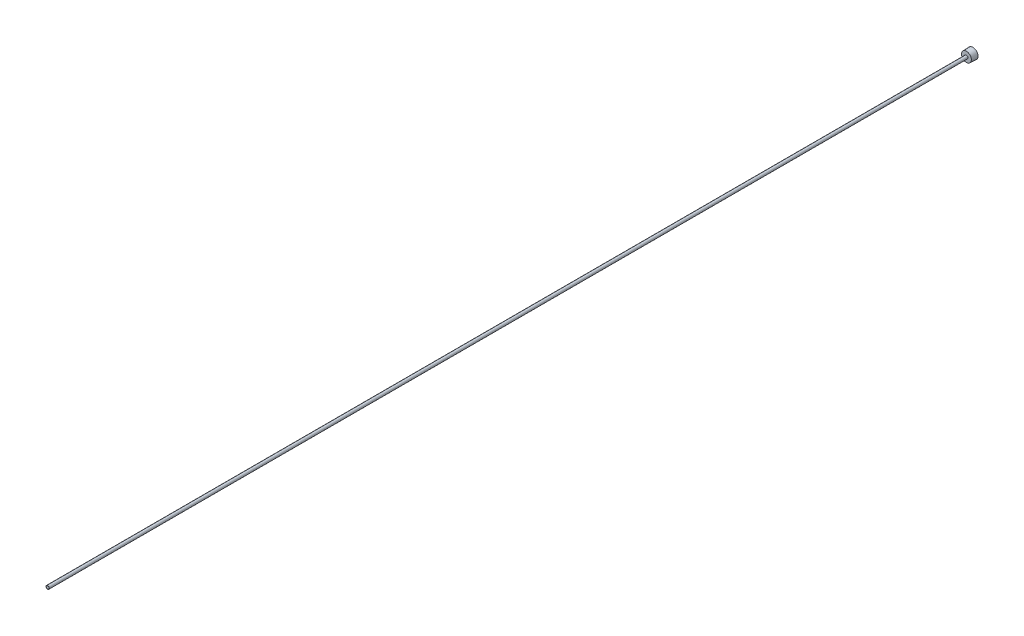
SolidWorks part; units mm, degrees
ref_plane "Front Plane" through (0, 0, 0) normal (0, 0, 1) x (1, 0, 0)
ref_plane "Top Plane" through (0, 0, 0) normal (0, 1, 0) x (1, 0, 0)
ref_plane "Right Plane" through (0, 0, 0) normal (1, 0, 0) x (0, 0, -1)
sketch "Sketch1" plane through (0, 0, 0) normal (1, 0, 0) x (0, 0, -1)
  line L5 (0, 0) -> (0, 5.0927)
  line L6 (0, 5.0927) -> (-6.35, 4.8611)
  line L7 (-6.35, 4.8611) -> (-6.35, 1.5875)
  line L8 (-6.35, 1.5875) -> (-914.4, 1.5875)
  line L9 (-914.4, 1.5875) -> (-914.4, 0)
  line L10 (0, 0) -> (50000, 0) construction
  line L11 (0, 0) -> (-914.4, 0)
  dimension "D1" = 3.175
  dimension "D2" = 10.1854
  dimension "D3" = 2.089
  dimension "D4" = 6.35
  dimension "D5" = 914.4
revolve "Revolve1" add sketch "Sketch1" angle 360 about L10
sketch "Sketch2" plane through (0, 0, 914.4) normal (0, 0, 1) x (1, 0, 0)
  circle A0 centre (0, 0) radius 1.3843
  dimension "D1" = 2.7686
extrude "Cut-Extrude1" cut sketch "Sketch2" against normal through all
sketch "Sketch3" plane through (0, 0, 0) normal (0, 0, -1) x (-1, 0, 0)
  line L0 (0, 5.602) -> (0, -5.602) construction
  line L1 (3.175, -1.8331) -> (3.175, 1.8331)
  line L2 (3.175, 1.8331) -> (0, 3.6662)
  line L3 (0, 3.6662) -> (-3.175, 1.8331)
  line L4 (-3.175, 1.8331) -> (-3.175, -1.8331)
  line L5 (-3.175, -1.8331) -> (0, -3.6662)
  line L6 (0, -3.6662) -> (3.175, -1.8331)
  circle A0 centre (0, 0) radius 3.175 construction
  dimension "D1" = 6.35
  dimension "D2" = 6.35
extrude "Cut-Extrude2" cut sketch "Sketch3" against normal blind 4.7625
